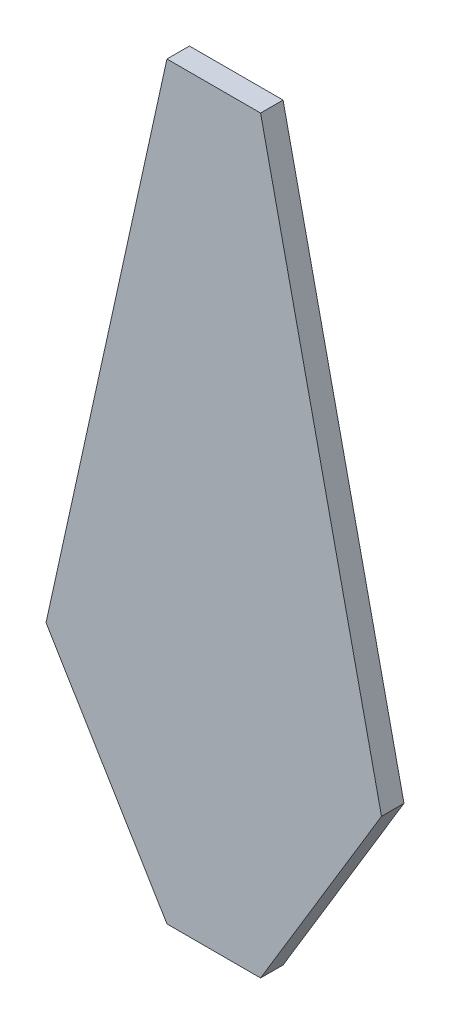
SolidWorks part; units mm, degrees
ref_plane "Plan de face" through (0, 0, 0) normal (0, 0, 1) x (1, 0, 0)
ref_plane "Plan de dessus" through (0, 0, 0) normal (0, 1, 0) x (1, 0, 0)
ref_plane "Plan de droite" through (0, 0, 0) normal (1, 0, 0) x (0, 0, -1)
sketch "Esquisse1" plane through (0, 0, 0) normal (0, 0, 1) x (1, 0, 0)
  line L0 (37.5, 0) -> (-37.5, 0)
  line L1 (-37.5, 0) -> (-134.3553, -439.4531)
  line L2 (0, 0) -> (0, -600) construction
  line L3 (37.5, -600) -> (-37.5, -600)
  line L4 (-134.3553, -439.4531) -> (-37.5, -600)
  line L5 (37.5, 0) -> (134.3553, -439.4531)
  line L6 (134.3553, -439.4531) -> (37.5, -600)
  dimension "D1" = 75
  dimension "D2" = 450
  dimension "D3" = 600
  dimension "D5" = 187.5
extrude "Boss.-Extru.1" add sketch "Esquisse1" along normal blind 18
sketch "Esquisse2" plane through (0, 0, 0) normal (0, 0, -1) x (-1, 0, 0)
  line L0 (0, 0) -> (0, -600) construction
  line L1 (37.5, -600) -> (-37.5, -600) construction
  line L2 (-84.3173, -212.42) -> (-27.5, -212.42) construction
  line L3 (27.5, -105) -> (-27.5, -105)
  line L4 (27.5, -105) -> (27.5, -555)
  line L5 (27.5, -555) -> (-27.5, -555)
  line L6 (-27.5, -105) -> (-27.5, -555)
  line L7 (27.5, -105) -> (-27.5, -555) construction
  line L8 (27.5, -555) -> (-27.5, -105) construction
  line L11 (-134.3553, -439.4531) -> (-37.5, 0) construction
  line L13 (27.5, -212.42) -> (84.3173, -212.42) construction
  line L14 (37.5, 0) -> (134.3553, -439.4531) construction
  point P5 (0, -300)
  point P10 (0, -300)
  dimension "D1" = 450
  dimension "D2" = 55
extrude "Enlèv. mat.-Extru.2" cut sketch "Esquisse2" against normal blind 10 contours L4 L3 L6 L5
sketch "Esquisse3" plane through (0, 0, 0) normal (0, 0, -1) x (-1, 0, 0)
  line L0 (0, 0) -> (0, -600) construction
  line L1 (37.5, -600) -> (-37.5, -600) construction
  line L2 (-8.376, 0) -> (-8.376, -100) construction
  line L3 (-32.6825, -100) -> (32.3175, -100)
  line L4 (-32.6825, -100) -> (-32.6825, -560)
  line L5 (-32.6825, -560) -> (32.3175, -560)
  line L6 (32.3175, -100) -> (32.3175, -560)
  line L7 (-32.6825, -100) -> (32.3175, -560) construction
  line L8 (-32.6825, -560) -> (32.3175, -100) construction
  line L9 (-37.5, 0) -> (37.5, 0) construction
  line L10 (-68.0325, -138.5323) -> (-32.6825, -138.5323) construction
  line L11 (-134.3553, -439.4531) -> (-37.5, 0) construction
  line L12 (32.3175, -138.5323) -> (68.0325, -138.5323) construction
  line L13 (37.5, 0) -> (134.3553, -439.4531) construction
  point P5 (-0.1825, -330)
  dimension "D1" = 65
  dimension "D2" = 460
  dimension "D3" = 100
  dimension "D4" = 35.35
  dimension "D5" = 35.715
extrude "Enlèv. mat.-Extru.4" cut sketch "Esquisse3" against normal blind 3
sketch "Esquisse6" plane through (0, 0, 3) normal (0, 0, -1) x (-1, 0, 0)
sketch "Esquisse7" plane through (0, 0, 0) normal (0, 0, -1) x (-1, 0, 0)
  line L0 (-3.8737, 0) -> (-3.8737, -15) construction
  line L1 (-8.25, -15) -> (8.25, -15)
  line L2 (-8.25, -15) -> (-8.25, -41.5)
  line L3 (-8.25, -41.5) -> (8.25, -41.5)
  line L4 (8.25, -15) -> (8.25, -41.5)
  line L5 (-37.5, 0) -> (37.5, 0) construction
  line L6 (-37.75, -1.1343) -> (-8.25, -1.1343) construction
  line L8 (-134.3553, -439.4531) -> (-37.5, 0) construction
  line L10 (8.25, -1.1343) -> (37.75, -1.1343) construction
  line L11 (37.5, 0) -> (134.3553, -439.4531) construction
  dimension "D1" = 26.5
  dimension "D2" = 16.5
  dimension "D3" = 15
  dimension "D4" = 29.5
  dimension "D5" = 29.5
extrude "Enlèv. mat.-Extru.5" cut sketch "Esquisse7" against normal blind 10
